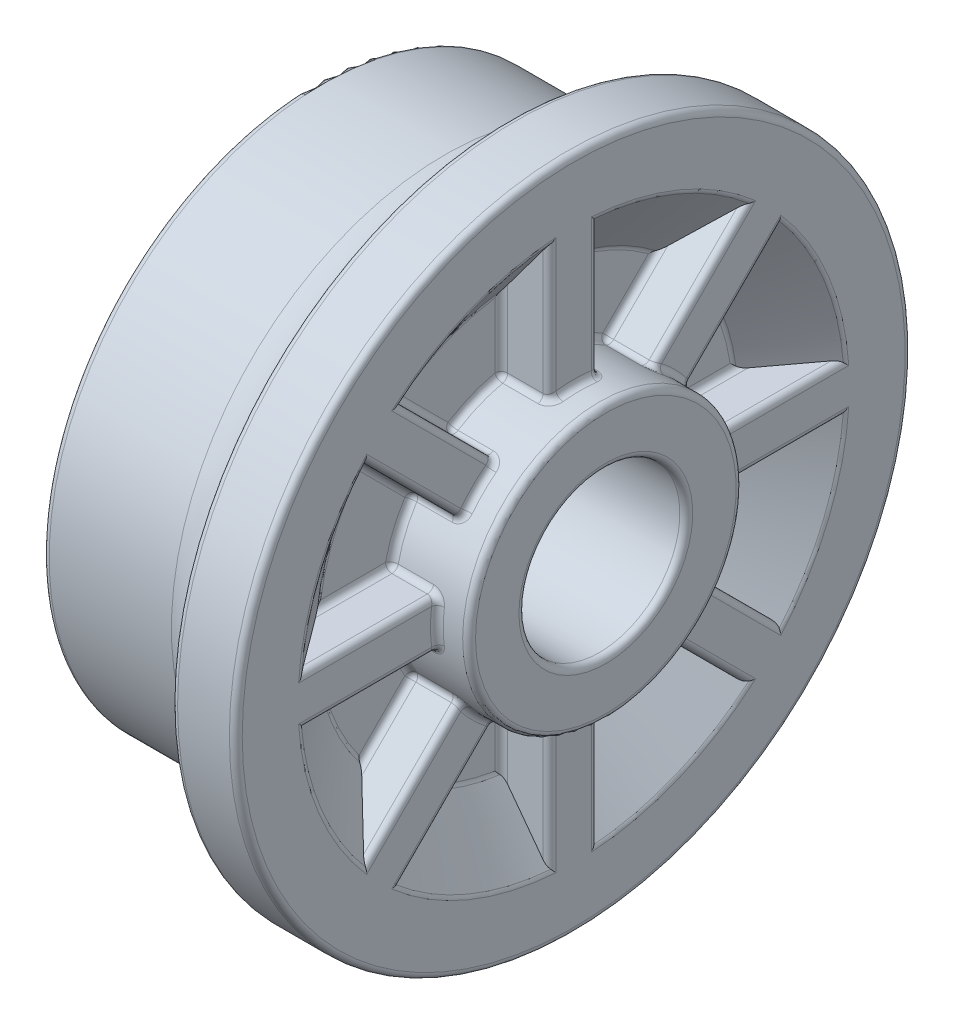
SolidWorks part; units mm, degrees
ref_plane "Face" through (0, 0, 0) normal (0, 0, 1) x (1, 0, 0)
ref_plane "Dessus" through (0, 0, 0) normal (0, 1, 0) x (1, 0, 0)
ref_plane "Droite" through (0, 0, 0) normal (1, 0, 0) x (0, 0, -1)
sketch "Esquisse1" plane through (0, 0, 0) normal (0, 0, 1) x (1, 0, 0)
  line L0 (0, 0) -> (31.8189, 0) construction
  line L1 (0, 2.5) -> (10, 2.5)
  line L2 (10, 2.5) -> (10, 4.25)
  line L3 (10, 4.25) -> (7.5, 4.25)
  line L4 (7.5, 4.25) -> (7.5, 6.5)
  line L5 (7.5, 6.5) -> (9, 8.5)
  line L6 (9, 8.5) -> (9, 10.5)
  line L7 (9, 10.5) -> (7, 10.5)
  line L8 (7, 10.5) -> (7, 8.5)
  line L9 (7, 8.5) -> (1, 8.5)
  line L10 (1, 8.5) -> (1, 7)
  line L11 (1, 7) -> (5, 7)
  line L12 (5, 7) -> (5, 4.25)
  line L13 (5, 4.25) -> (0, 4.25)
  line L14 (0, 4.25) -> (0, 2.5)
  dimension "D1" = 5
  dimension "D2" = 8.5
  dimension "D3" = 14
  dimension "D4" = 17
  dimension "D5" = 21
  dimension "D6" = 10
  dimension "D7" = 9
  dimension "D8" = 1
  dimension "D9" = 4
  dimension "D10" = 6
  dimension "D11" = 2
  dimension "D12" = 1.5
  dimension "D13" = 2
revolve "Révolution1" add sketch "Esquisse1" angle 360 about L0
fillet "Congé1" radius 2
sketch "Esquisse3" plane through (9, 0, 0) normal (1, 0, 0) x (0, 0, -1)
  line L0 (0, 0) -> (16.4346, 0) construction
  line L1 (3.6498, 0.75) -> (9.5148, 0.75)
  line L2 (3.6498, -0.75) -> (9.5148, -0.75)
  line L3 (9.5148, 0.75) -> (9.5148, -0.75)
  line L4 (3.6498, 0.75) -> (3.6498, -0.75)
  point P8 (9.5148, 0)
  point P9 (3.6498, 0)
  dimension "D1" = 1.5
extrude "Extrusion1" add sketch "Esquisse3" against normal up to body separate body
pattern_circular "Répétition circulaire1" count 8 over 360 about axis through (0, 0, 0) along (1, 0, 0)
sketch "Esquisse4" plane through (5, 0, 0) normal (-1, 0, 0) x (0, 0, 1)
  line L0 (0, 0) -> (0, 9.9789) construction
  line L1 (-0.75, 7) -> (-0.75, 3)
  line L2 (0.75, 7) -> (0.75, 3)
  line L3 (-0.75, 3) -> (0.75, 3)
  line L4 (-0.75, 7) -> (0, 7)
  line L5 (0.75, 7) -> (0, 7)
  point P8 (0, 3)
  dimension "D1" = 3
  dimension "D2" = 4
  dimension "D3" = 0.75
extrude "Extrusion2" add sketch "Esquisse4" along normal blind 3
pattern_circular "Répétition circulaire2" count 4 over 360 about axis through (0, 0, 0) along (1, 0, 0)
fillet "Congé2" radius 0.2
